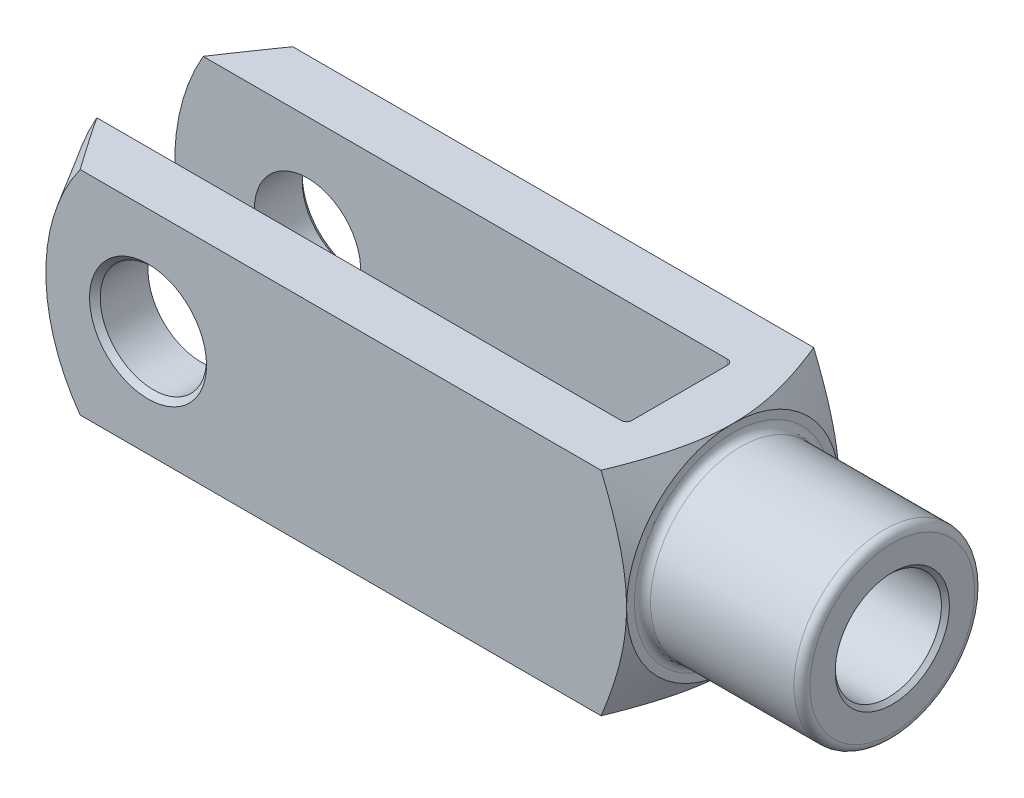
SolidWorks part; units mm, degrees
ref_plane "Front Plane" through (0, 0, 0) normal (0, 0, 1) x (1, 0, 0)
ref_plane "Top Plane" through (0, 0, 0) normal (0, 1, 0) x (1, 0, 0)
ref_plane "Right Plane" through (0, 0, 0) normal (1, 0, 0) x (0, 0, -1)
sketch "Sketch1" plane through (0, 0, 0) normal (1, 0, 0) x (0, 0, -1)
  line L0 (0, 0) -> (0, 50000) construction
  line L1 (0, 0) -> (50000, 0) construction
  line L2 (-20, -20) -> (-20, 20)
  line L3 (-20, 20) -> (20, 20)
  line L4 (20, -20) -> (20, 20)
  line L5 (-20, -20) -> (20, -20)
  point P9 (0, 20)
  point P11 (20, 0)
  point P12 (-20, 0)
  dimension "D1" = 40
  dimension "D2" = 40
extrude "Extrude1" add sketch "Sketch1" against normal blind 145
sketch "Sketch2" plane through (0, 0, 0) normal (1, 0, 0) x (0, 0, -1)
  circle A0 centre (0, 0) radius 17
  circle A1 centre (0, 0) radius 34
  dimension "D1" = 34
  dimension "D2" = 68
extrude "Extrude2" cut sketch "Sketch2" against normal blind 30
sketch "Sketch3" plane through (0, 0, 20) normal (0, 0, 1) x (1, 0, 0)
  circle A0 centre (-120, 0) radius 10
  dimension "D1" = 20
  dimension "D2" = 120
extrude "Extrude3" cut sketch "Sketch3" against normal through all
sketch "Sketch4" plane through (0, 20, 0) normal (0, 1, 0) x (1, 0, 0)
  line L0 (0, 0) -> (-50000, 0) construction
  line L1 (-145, -10) -> (-145, 10)
  line L2 (-145, 20) -> (-145, -20) construction
  line L3 (-145, 10) -> (-40, 10)
  line L4 (-40, 10) -> (-40, -10)
  line L5 (-120, 20) -> (-120, -20) construction
  line L6 (-145, -10) -> (-40, -10)
  point P7 (-120, 0)
  point P13 (-40, 0)
  point P14 (-145, 0)
  dimension "D1" = 80
  dimension "D2" = 20
extrude "Extrude4" cut sketch "Sketch4" against normal through all
fillet "Fillet1" radius 1 2 edges at (-40, 0, 10) (-40, 0, -10)
fillet "Fillet2" radius 1.5 2 edges at (0, 0, -17) (-30, 0, -17)
chamfer "Chamfer2" distance 1 angle 45 2 edges at (-110, 0, -20) (-110, 0, 20)
sketch "Sketch6" plane through (0, 0, 0) normal (0, 0, 1) x (1, 0, 0)
  line L0 (-30, -20) -> (-30, -40)
  line L1 (-30, -40) -> (-41.547, -40)
  line L2 (-41.547, -40) -> (-30, -20)
  dimension "D1" = 30
  dimension "D2" = 40
revolve "Cut-Revolve1" cut sketch "Sketch6" angle 360 about axis through (-30, 0, 0) along (1, 0, 0)
sketch "Sketch7" plane through (0, 0, 0) normal (0, 1, 0) x (1, 0, 0)
  line L0 (-139.2265, -20) -> (-145, -10)
  line L1 (-145, 10) -> (-139.2265, 20)
  line L2 (-139.2265, 20) -> (-185, 20)
  line L3 (-145, 10) -> (-145, -10)
  line L4 (-185, 20) -> (-185, -20)
  line L5 (-185, -20) -> (-139.2265, -20)
  line L6 (-145, 20) -> (-34.7829, 20) construction
  line L7 (-145, -20) -> (-34.7829, -20) construction
  line L8 (-105, 0.6162) -> (-105, 50000.6162) construction
  dimension "D1" = 120
  dimension "D2" = 40
  dimension "D3" = 40
revolve "Cut-Revolve2" cut sketch "Sketch7" angle 180 about L8
sketch "Sketch8" plane through (0, 0, 0) normal (1, 0, 0) x (0, 0, -1)
  circle A0 centre (0, 0) radius 10
  dimension "D1" = 20
extrude "Extrude5" cut sketch "Sketch8" against normal through all
chamfer "Chamfer3" distance 0.75 angle 45 1 edges at (0, 0, -10)
equation "\"D2@Sketch1\" = \"D1@Sketch1\""
equation "\"D2@Sketch2\" = \"D1@Sketch2\"*2"
equation "\"D2@Sketch6\" = \"D1@Sketch1\""
equation "\"D2@Sketch7\" = \"D1@Sketch1\""
equation "\"D3@Sketch7\" = \"D1@Sketch1\""
